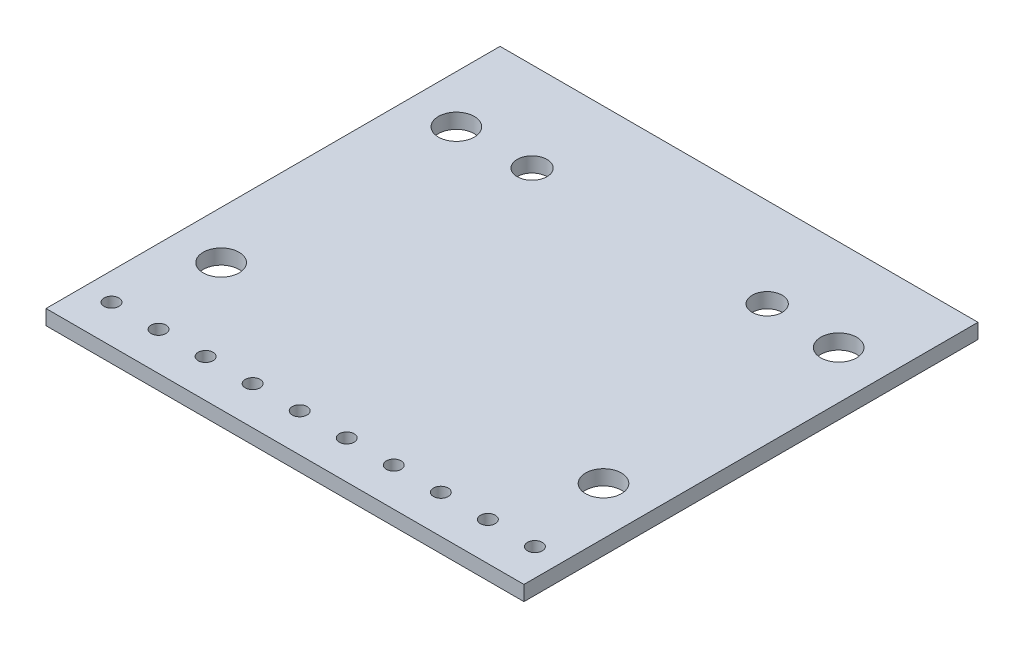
SolidWorks part; units mm, degrees
ref_plane "Front Plane" through (0, 0, 0) normal (0, 0, 1) x (1, 0, 0)
ref_plane "Top Plane" through (0, 0, 0) normal (0, 1, 0) x (1, 0, 0)
ref_plane "Right Plane" through (0, 0, 0) normal (1, 0, 0) x (0, 0, -1)
sketch "Sketch1" plane through (0, 0, 0) normal (0, 1, 0) x (1, 0, 0)
  line L0 (25.4, 48.26) -> (25.4, 0) construction
  line L1 (0, 0) -> (50.8, 0)
  line L2 (0, 0) -> (0, 48.26)
  line L3 (0, 48.26) -> (50.8, 48.26)
  line L4 (50.8, 0) -> (50.8, 48.26)
  circle A0 centre (5.08, 13.535) radius 1.905
  circle A1 centre (5.08, 38.535) radius 1.905
  circle A2 centre (45.72, 13.535) radius 1.905
  circle A3 centre (45.72, 38.535) radius 1.905
  circle A4 centre (5.08, 26.035) radius 1.905 construction
  circle A5 centre (45.72, 26.035) radius 1.905 construction
  dimension "D3" = 5.08
  dimension "D4" = 12.5
  dimension "D5" = 12.5
  dimension "D6" = 3.81
  dimension "D7" = 26.035
  dimension "D1" = 50.8
  dimension "D2" = 48.26
extrude "Boss-Extrude1" add sketch "Sketch1" against normal blind 1.5875
sketch "Sketch2" plane through (0, 0, 0) normal (0, 1, 0) x (1, 0, 0)
  line L0 (22.9, 4.064) -> (27.9, 4.064) construction
  line L1 (0, 0) -> (50.8, 0) construction
  line L2 (2.9, 4.064) -> (7.9, 4.064) construction
  line L3 (25.4, 48.26) -> (25.4, 0) construction
  line L4 (50.8, 48.26) -> (0, 48.26) construction
  circle A0 centre (2.9, 4.064) radius 0.7874
  circle A1 centre (7.9, 4.064) radius 0.7874
  circle A2 centre (12.9, 4.064) radius 0.7874
  circle A3 centre (17.9, 4.064) radius 0.7874
  circle A4 centre (22.9, 4.064) radius 0.7874
  circle A5 centre (27.9, 4.064) radius 0.7874
  circle A6 centre (32.9, 4.064) radius 0.7874
  circle A7 centre (37.9, 4.064) radius 0.7874
  circle A8 centre (42.9, 4.064) radius 0.7874
  circle A9 centre (47.9, 4.064) radius 0.7874
  point P28 (25.4, 4.064)
  dimension "D2" = 4.064
  dimension "D5" = 1.5748
  dimension "D4" = 5
  dimension "D3" = 10
extrude "screwHoles" cut sketch "Sketch2" against normal through all
sketch "Sketch3" plane through (0, 0, 0) normal (0, 1, 0) x (1, 0, 0)
  line L2 (25.4, 48.26) -> (25.4, 0) construction
  line L3 (50.8, 48.26) -> (0, 48.26) construction
  line L4 (0, 0) -> (50.8, 0) construction
  circle A0 centre (12.905, 38.76) radius 1.59
  circle A1 centre (37.895, 38.76) radius 1.59
  dimension "D1" = 3.18
  dimension "D3" = 9.5
  dimension "D2" = 24.99
extrude "Cut-Extrude2" cut sketch "Sketch3" against normal through all
sketch "Sketch4" plane through (0, 0, 0) normal (0, 1, 0) x (1, 0, 0)
  line L0 (0, 9.8298) -> (50.8, 9.8298) construction
  line L1 (0, 48.26) -> (0, 0) construction
  line L2 (50.8, 0) -> (50.8, 48.26) construction
  line L3 (0, 0) -> (50.8, 0) construction
  text T0 "DB9M" font "Arial Rounded MT Bold" height in points 16
  dimension "D1" = 9.8298
ref_plane "Plane2" [suppressed] through (25.4, 0, 0) normal (1, 0, 0) x (0, 0, -1)
sketch "Sketch5" [suppressed] plane through (0, 0, 0) normal (0, 1, 0) x (1, 0, 0)
  line L0 (21.245, 40.48) -> (21.245, 39.88) construction
  line L1 (21.565, 40.48) -> (20.925, 40.48) construction
  line L2 (21.565, 39.88) -> (20.925, 39.88) construction
  line L3 (24.015, 40.48) -> (24.015, 39.88) construction
  line L4 (24.335, 40.48) -> (23.695, 40.48) construction
  line L5 (24.335, 39.88) -> (23.695, 39.88) construction
  line L6 (26.785, 40.48) -> (26.785, 39.88) construction
  line L7 (27.105, 40.48) -> (26.465, 40.48) construction
  line L8 (27.105, 39.88) -> (26.465, 39.88) construction
  line L9 (29.555, 40.48) -> (29.555, 39.88) construction
  line L10 (29.875, 40.48) -> (29.235, 40.48) construction
  line L11 (29.875, 39.88) -> (29.235, 39.88) construction
  line L12 (19.86, 37.64) -> (19.86, 37.04) construction
  line L13 (20.18, 37.64) -> (19.54, 37.64) construction
  line L14 (20.18, 37.04) -> (19.54, 37.04) construction
  line L15 (22.63, 37.64) -> (22.63, 37.04) construction
  line L16 (22.95, 37.64) -> (22.31, 37.64) construction
  line L17 (22.95, 37.04) -> (22.31, 37.04) construction
  line L18 (25.4, 37.64) -> (25.4, 37.04) construction
  line L19 (25.72, 37.64) -> (25.08, 37.64) construction
  line L20 (25.72, 37.04) -> (25.08, 37.04) construction
  line L21 (28.17, 37.64) -> (28.17, 37.04) construction
  line L22 (28.49, 37.64) -> (27.85, 37.64) construction
  line L23 (28.49, 37.04) -> (27.85, 37.04) construction
  line L24 (30.94, 37.64) -> (30.94, 37.04) construction
  line L25 (31.26, 37.64) -> (30.62, 37.64) construction
  line L26 (31.26, 37.04) -> (30.62, 37.04) construction
  line L27 (21.245, 40.48) -> (21.565, 40.48) construction
  circle A0 centre (21.245, 40.18) radius 0.4386
  circle A1 centre (24.015, 40.18) radius 0.4386
  circle A2 centre (26.785, 40.18) radius 0.4386
  circle A3 centre (29.555, 40.18) radius 0.4386
  circle A4 centre (19.86, 37.34) radius 0.4386
  circle A5 centre (22.63, 37.34) radius 0.4386
  circle A6 centre (25.4, 37.34) radius 0.4386
  circle A7 centre (28.17, 37.34) radius 0.4386
  circle A8 centre (30.94, 37.34) radius 0.4386
extrude "Cut-Extrude3" [suppressed] cut sketch "Sketch5" against normal through all
